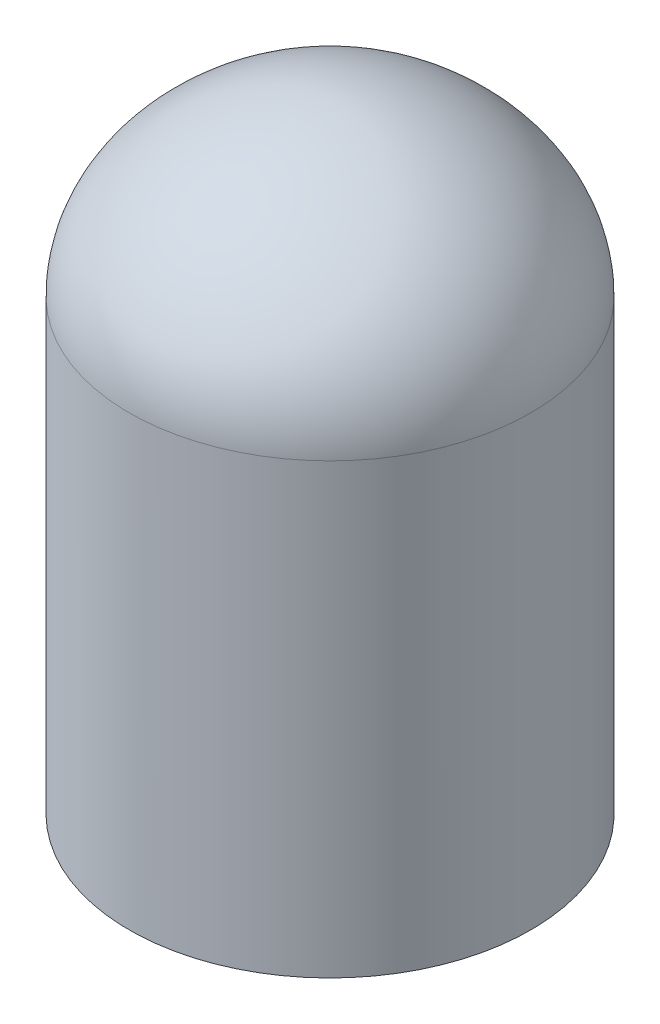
SolidWorks part; units mm, degrees
ref_plane "Plan de face" through (0, 0, 0) normal (0, 0, 1) x (1, 0, 0)
ref_plane "Plan de dessus" through (0, 0, 0) normal (0, 1, 0) x (1, 0, 0)
ref_plane "Plan de droite" through (0, 0, 0) normal (1, 0, 0) x (0, 0, -1)
ref_plane "Plan1" through (0, 0, 334.5) normal (0, 0, 1) x (1, 0, 0)
sketch "Esquisse3" plane through (0, 0, 334.5) normal (0, 0, 1) x (1, 0, 0)
  line L0 (-11.8769, 91.9883) -> (-11.8769, 24.6777) construction
  line L1 (7.6231, -5.5112) -> (7.6231, 66.4888) construction
  line L2 (1.6231, 75.15) -> (7.6231, 78.6141)
  line L3 (7.6231, 61.7126) -> (7.6231, 100.4913) construction
  line L6 (-11.8769, 30.15) -> (0.6231, 30.15)
  line L7 (0.6231, 30.15) -> (0.6231, 75.15)
  line L8 (0.6231, 75.15) -> (1.6231, 75.15)
  line L10 (7.6231, 78.6141) -> (7.6231, 90.15)
  line L13 (-11.8769, 30.15) -> (-11.8769, 73.6317)
  spline S0 degree 3 poles (-11.8769, 73.6317) (-11.8769, 83.2203) (-1.1558, 90.15) (7.6231, 90.15) knots 0 0 0 0 1 1 1 1
  dimension "D1" = 19.5
  dimension "D2" = 7
  dimension "D3" = 60
  dimension "D4" = 6
  dimension "D5" = 45
  dimension "D6" = 60
revolve "Révolution1" add sketch "Esquisse3" angle 360 about L10
